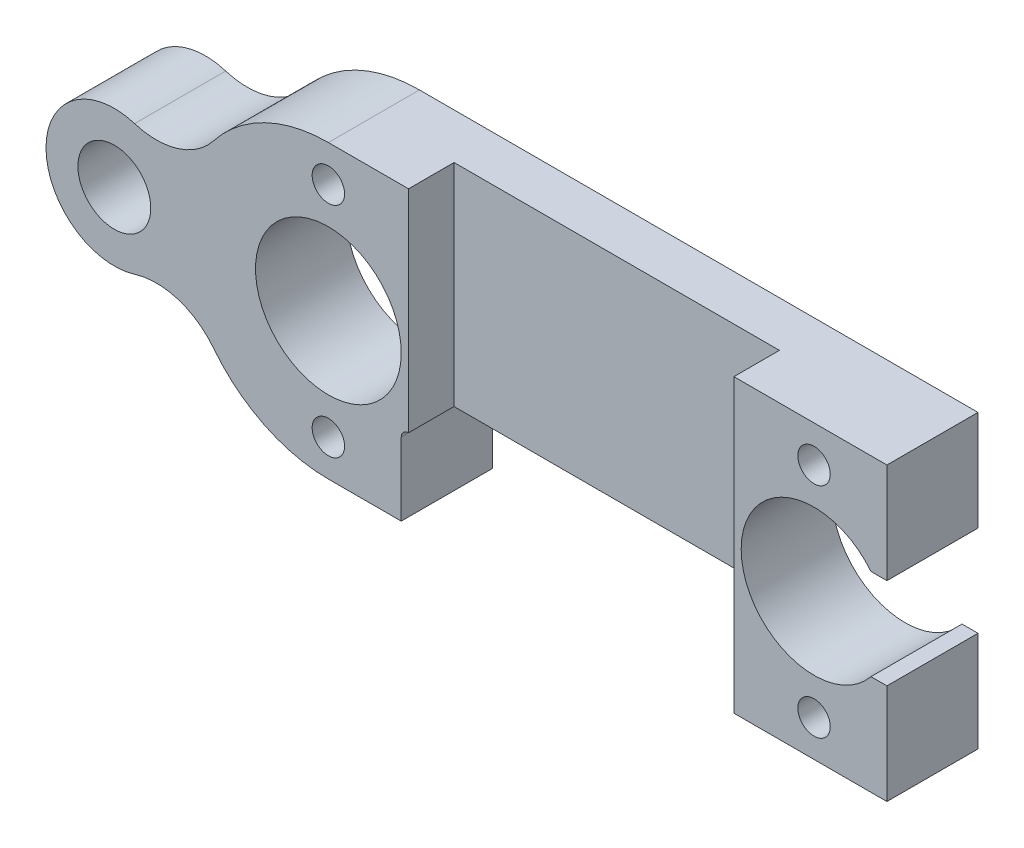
SolidWorks part; units mm, degrees
ref_plane "Front Plane" through (0, 0, 0) normal (0, 0, 1) x (1, 0, 0)
ref_plane "Top Plane" through (0, 0, 0) normal (0, 1, 0) x (1, 0, 0)
ref_plane "Right Plane" through (0, 0, 0) normal (1, 0, 0) x (0, 0, -1)
sketch "Sketch1" plane through (0, 0, 0) normal (0, 0, 1) x (1, 0, 0)
  line L0 (24.333, 15.5447) -> (-14.6052, 15.5447)
  line L1 (-14.6052, -4.7753) -> (-9.5252, -4.7753)
  line L2 (-29.5277, 5.3847) -> (-20.9552, 5.3847) construction
  line L4 (13.665, -4.7753) -> (13.665, 0.8127)
  line L5 (-29.5277, 5.3847) -> (-29.5277, -2.6671) construction
  line L6 (-20.9552, 13.4365) -> (-29.007, 5.3847) construction
  line L7 (-29.5277, 5.3847) -> (-36.5542, 5.3847) construction
  line L8 (-36.5542, 5.3847) -> (-36.5542, 16.8147) construction
  line L9 (-20.9552, 13.4365) -> (-20.9552, -2.6671) construction
  line L10 (-29.5277, -2.6671) -> (-20.9552, -2.6671) construction
  line L11 (13.665, 0.8127) -> (-9.5252, 0.8127)
  line L13 (-29.007, 5.3847) -> (-20.9552, -2.6671) construction
  line L14 (-29.5277, 12.1287) -> (-29.5277, 33.6835) construction
  line L15 (-36.5542, 16.8147) -> (-29.5277, 16.8147) construction
  line L16 (-36.5542, 11.0997) -> (-29.5277, 11.0997) construction
  line L17 (-29.5277, 5.3847) -> (-29.5277, 136.5438) construction
  line L18 (-29.5277, 136.5438) -> (0, 0) construction
  line L19 (10.7694, 5.3847) -> (38.2554, 5.3847) construction
  line L20 (13.665, -4.7753) -> (24.333, -4.7753)
  line L21 (24.333, -4.7753) -> (24.333, 2.2097)
  line L23 (19.253, 5.3847) -> (-14.6052, 5.3847) construction
  line L24 (-20.9552, 5.3847) -> (-14.6052, 5.3847) construction
  line L26 (-9.5252, 0.8127) -> (-9.5252, -4.7753)
  line L27 (2.3239, 9.4371) -> (2.3239, 5.3847) construction
  line L28 (24.333, 8.5597) -> (23.2186, 8.5597)
  line L29 (2.3239, 0.8127) -> (2.3239, 5.3847) construction
  line L30 (23.2186, 2.2097) -> (24.333, 2.2097)
  line L31 (24.333, 8.5597) -> (24.333, 15.5447)
  line L32 (23.2186, 2.2097) -> (23.2186, 8.5597) construction
  circle A0 centre (-14.6052, 5.3847) radius 5.08
  arc A1 (-14.6052, 15.5447) -> (-22.6035, 11.6499) centre (-14.6052, 5.3847) ccw
  arc A2 (-28.1124, 9.932) -> (-28.1124, 0.8373) centre (-29.5277, 5.3847) ccw
  circle A3 centre (-29.5277, 5.3847) radius 2.54
  arc A4 (-22.6035, -0.8805) -> (-14.6052, -4.7753) centre (-14.6052, 5.3847) ccw
  circle A5 centre (-29.5277, 136.5438) radius 139.7 construction
  circle A6 centre (19.253, 5.3847) radius 3.9688 construction
  arc A7 (23.2186, 8.5597) -> (23.2186, 2.2097) centre (19.253, 5.3847) ccw
  circle A8 centre (2.3239, 5.3847) radius 3.175 construction
  circle A9 centre (-14.6052, 5.3847) radius 3.9688 construction
  arc A10 (-28.1124, 9.932) -> (-22.6035, 11.6499) centre (-26.6027, 14.7825) ccw
  arc A11 (-28.1124, 0.8373) -> (-22.6035, -0.8805) centre (-26.6027, -4.0132) cw
  arc A12 (-28.1124, 9.932) -> (-28.1124, 0.8373) centre (-29.5277, 5.3847) ccw construction
  point P30 (24.333, 5.3847)
  dimension "D4" = 5.08
  dimension "D5" = 90
  dimension "D6" = 10.16
  dimension "D8" = 11.43
  dimension "D2" = 5.08
  dimension "D9" = 139.7
  dimension "D12" = 6.35
  dimension "D13" = 6.35
  dimension "D14" = 4.7625
  dimension "D15" = 5.08
  dimension "D3" = 5.588
  dimension "D16" = 5.08
  dimension "D17" = 5.588
  dimension "D7" = 6.35
  dimension "D10" = 20.32
  dimension "D11" = 5.08
extrude "Boss-Extrude1" add sketch "Sketch1" along normal blind 6.35
hole_wizard "#4-40 Tapped Hole1" positions "Sketch3" profile "Sketch2" tap size "#4-40" standard "ANSI Inch"
sketch "Sketch3" plane through (0, 0, 6.35) normal (0, 0, 1) x (1, 0, 0)
  line L0 (19.253, -2.2353) -> (19.253, 5.3847) construction
  line L1 (19.253, 5.3847) -> (19.253, 13.0047) construction
  line L3 (19.253, -2.2353) -> (-14.6052, -2.2353) construction
  line L5 (-14.6052, 13.0047) -> (19.253, 13.0047) construction
  line L7 (-14.6052, -2.2353) -> (-14.6052, 5.3847) construction
  line L8 (-14.6052, 5.3847) -> (-14.6052, 13.0047) construction
  point P0 (19.253, -2.2353)
  point P2 (19.253, 13.0047)
  point P4 (-14.6052, 13.0047)
  point P6 (-14.6052, -2.2353)
  dimension "D1" = 15.24
sketch "Sketch2" plane through (19.253, -2.2353, 6.35) normal (1, 0, 0) x (0, -1, 0)
  line L0 (0, 0) -> (0, 6.35)
  line L1 (0, 6.35) -> (1.1303, 6.35)
  line L2 (1.1303, 6.35) -> (1.1303, 0)
  line L5 (1.1303, 0) -> (0, 0)
  line L11 (0, -6.35) -> (0, 107.95) construction
  dimension "Thread Major Dia." = 2.2606
  dimension "Thru Tap Drill Depth" = 6.35
sketch "Sketch5" plane through (0, 0, 6.35) normal (0, 0, 1) x (1, 0, 0)
  line L0 (24.333, 15.5447) -> (-14.6052, 15.5447) construction
  line L1 (7.4252, 15.5447) -> (-2.7774, 15.5447)
  line L2 (7.4252, 15.5447) -> (7.4252, 8.5597)
  line L3 (7.4252, 8.5597) -> (-2.7774, 8.5597)
  line L4 (-2.7774, 15.5447) -> (-2.7774, 8.5597)
  line L5 (19.253, 5.3847) -> (-14.6052, 5.3847) construction
  line L6 (2.3239, 8.5597) -> (2.3239, 5.3847) construction
  dimension "D1" = 6.35
extrude "Cut-Extrude1" [suppressed] cut sketch "Sketch5" against normal through all
fillet "Fillet1" radius 0.508 2 edges at (-9.5252, 0.8127, 3.175) (13.665, 0.8127, 3.175)
sketch "Sketch6" plane through (0, 0, 6.35) normal (0, 0, 1) x (1, 0, 0)
  line L0 (24.333, 15.5447) -> (-14.6052, 15.5447) construction
  line L1 (13.665, -4.7753) -> (-9.0172, -4.7753)
  line L2 (13.665, -4.7753) -> (13.665, 15.5447)
  line L3 (13.665, 15.5447) -> (-9.0172, 15.5447)
  line L4 (-9.0172, -4.7753) -> (-9.0172, 15.5447)
  circle A0 centre (-14.6052, 5.3847) radius 5.08 construction
  dimension "D1" = 5.588
extrude "Cut-Extrude2" cut sketch "Sketch6" against normal blind 3.175
